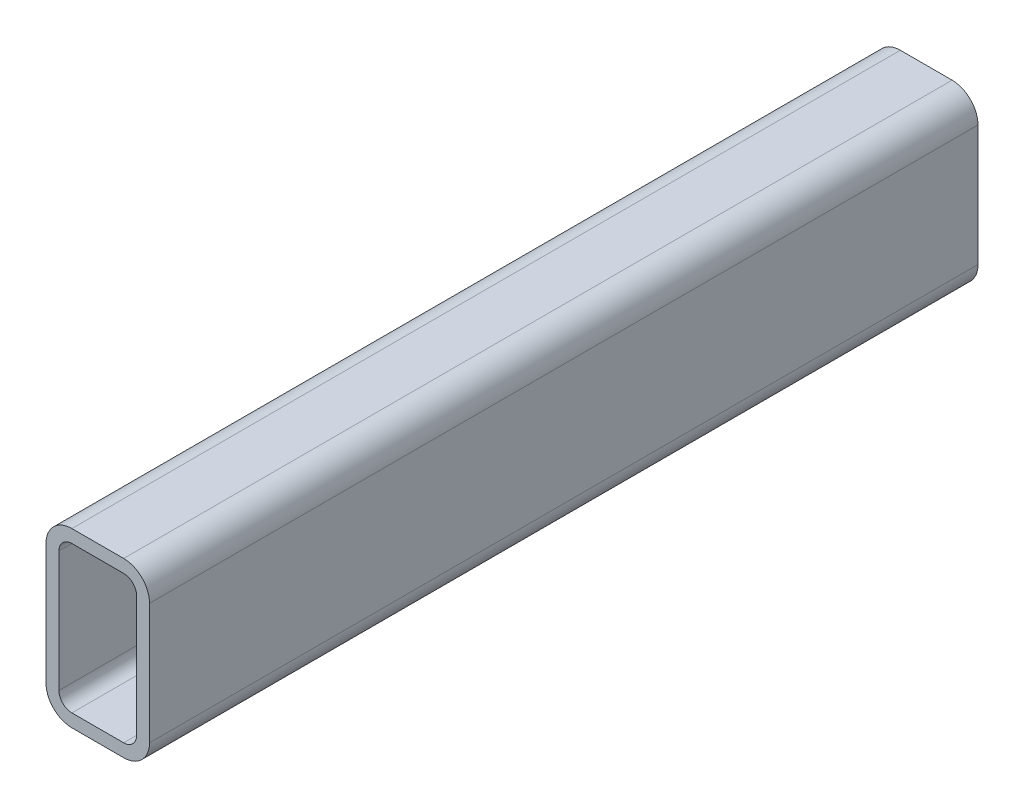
SolidWorks part; units mm, degrees
ref_plane "Front Plane" through (0, 0, 0) normal (0, 0, 1) x (1, 0, 0)
ref_plane "Top Plane" through (0, 0, 0) normal (0, 1, 0) x (1, 0, 0)
ref_plane "Right Plane" through (0, 0, 0) normal (1, 0, 0) x (0, 0, -1)
sketch "Sketch1" plane through (0, 0, 0) normal (0, 0, 1) x (1, 0, 0)
  line B0 (38.1, 53.975) -> (38.1, 9.525)
  arc B1 (0, 9.525) -> (9.525, 0) centre (9.525, 9.525) ccw
  line B2 (0, 9.525) -> (0, 53.975)
  line B3 (4.7625, 9.525) -> (4.7625, 53.975)
  line B4 (9.525, 63.5) -> (28.575, 63.5)
  arc B5 (38.1, 53.975) -> (28.575, 63.5) centre (28.575, 53.975) ccw
  arc B6 (28.575, 0) -> (38.1, 9.525) centre (28.575, 9.525) ccw
  line B7 (28.575, 0) -> (9.525, 0)
  arc B8 (9.525, 63.5) -> (0, 53.975) centre (9.525, 53.975) ccw
  line B9 (9.525, 58.7375) -> (28.575, 58.7375)
  arc B10 (33.3375, 53.975) -> (28.575, 58.7375) centre (28.575, 53.975) ccw
  line B11 (33.3375, 53.975) -> (33.3375, 9.525)
  arc B12 (28.575, 4.7625) -> (33.3375, 9.525) centre (28.575, 9.525) ccw
  line B13 (28.575, 4.7625) -> (9.525, 4.7625)
  arc B14 (4.7625, 9.525) -> (9.525, 4.7625) centre (9.525, 9.525) ccw
  arc B15 (9.525, 58.7375) -> (4.7625, 53.975) centre (9.525, 53.975) ccw
sketch_block_instance "HSS2.5x1.5x0.1875-1"
sketch_block "HSS2.5x1.5x0.1875"
extrude "Boss-Extrude1" add sketch "Sketch1" along normal blind 304.8
